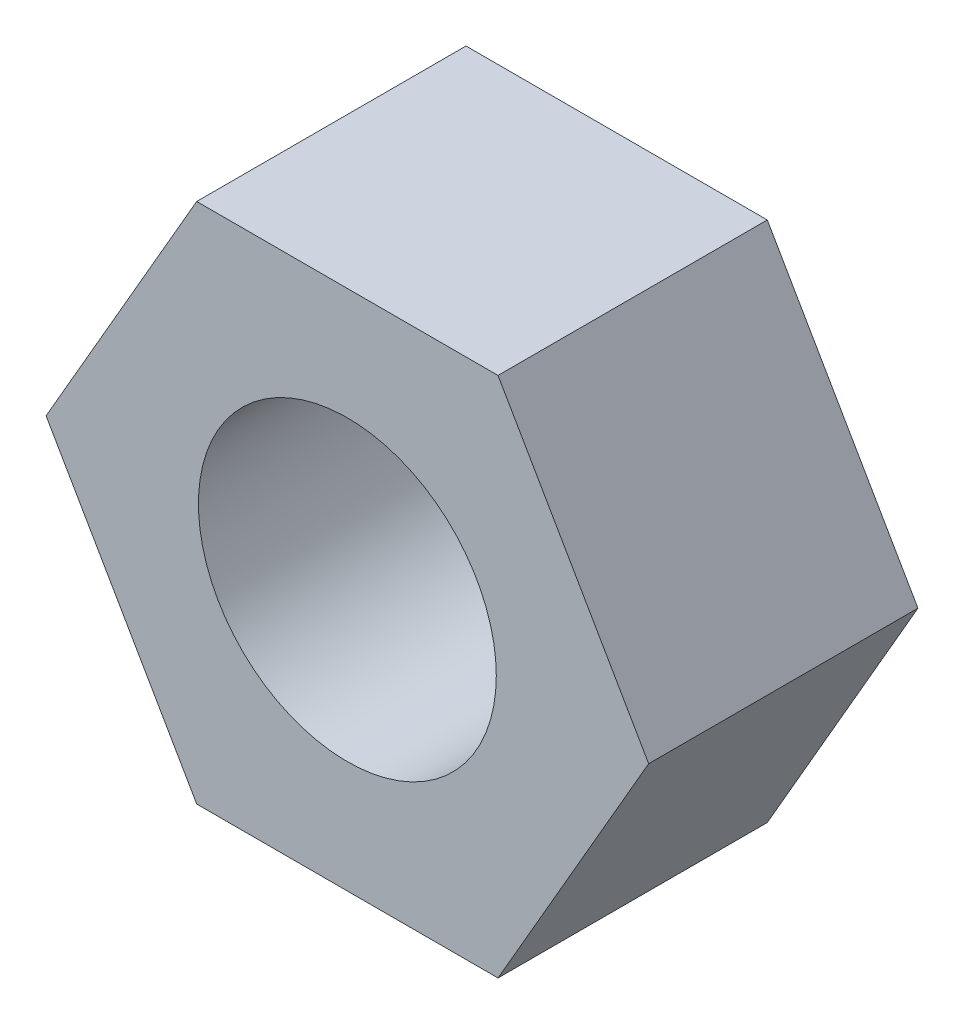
SolidWorks part; units mm, degrees
ref_plane "Front" through (0, 0, 0) normal (0, 0, 1) x (1, 0, 0)
ref_plane "Top" through (0, 0, 0) normal (0, 1, 0) x (1, 0, 0)
ref_plane "Right" through (0, 0, 0) normal (1, 0, 0) x (0, 0, -1)
sketch "Sketch1" plane through (0, 0, 0) normal (0, 0, 1) x (1, 0, 0)
  line L1 (3.2116, -5.5626) -> (6.4231, 0)
  line L2 (6.4231, 0) -> (3.2116, 5.5626)
  line L3 (3.2116, 5.5626) -> (-3.2116, 5.5626)
  line L4 (-3.2116, 5.5626) -> (-6.4231, 0)
  line L5 (-6.4231, 0) -> (-3.2116, -5.5626)
  line L6 (-3.2116, -5.5626) -> (3.2116, -5.5626)
  circle A0 centre (0, 0) radius 5.5626 construction
  dimension "D1" = 11.1252
extrude "Extrude1" add sketch "Sketch1" along normal blind 5.7404
sketch "Sketch2" plane through (0, 0, 5.7404) normal (0, 0, 1) x (1, 0, 0)
  circle A0 centre (0, 0) radius 3.175
  dimension "D1" = 6.35
extrude "Cut-Extrude1" cut sketch "Sketch2" against normal blind 5.7404
